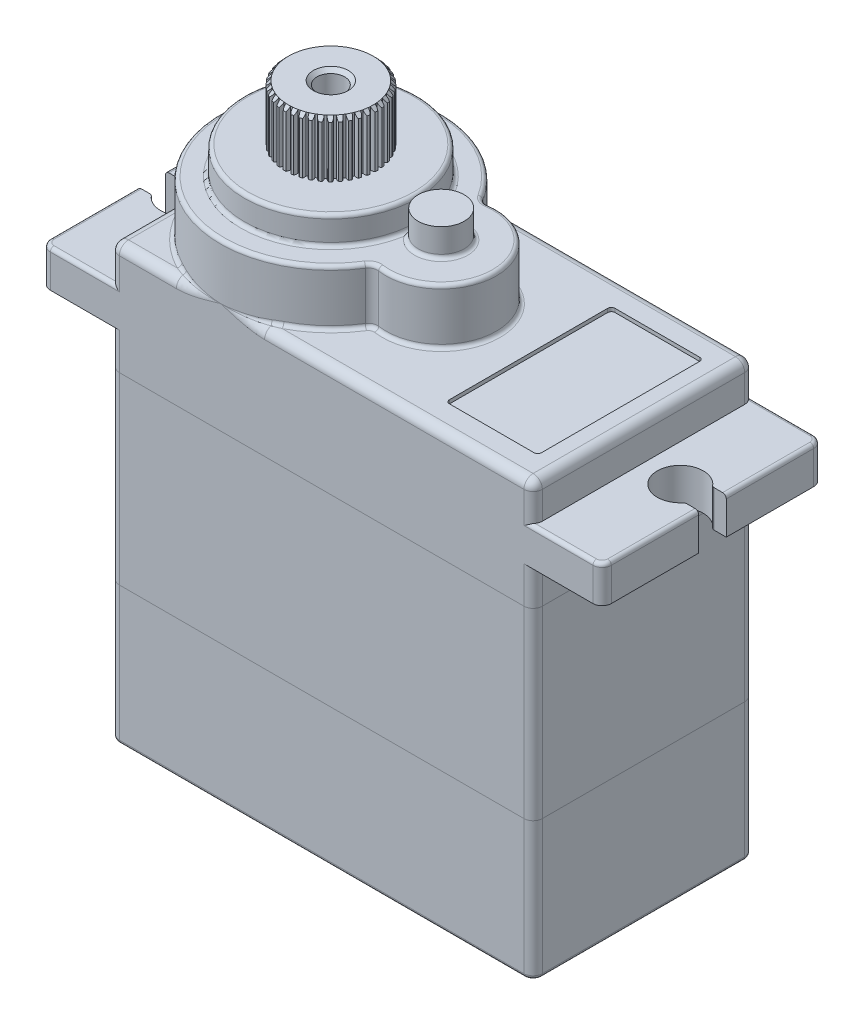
SolidWorks part; units mm, degrees
ref_plane "Front Plane" through (0, 0, 0) normal (0, 0, 1) x (1, 0, 0)
ref_plane "Top Plane" through (0, 0, 0) normal (0, 1, 0) x (1, 0, 0)
ref_plane "Right Plane" through (0, 0, 0) normal (1, 0, 0) x (0, 0, -1)
sketch "Sketch1" plane through (0, 0, 0) normal (0, 1, 0) x (1, 0, 0)
  line L1 (-11.5, 6) -> (11.5, 6)
  line L2 (-11.5, 6) -> (-11.5, -6)
  line L3 (-11.5, -6) -> (11.5, -6)
  line L4 (11.5, 6) -> (11.5, -6)
  line L5 (-11.5, 6) -> (11.5, -6) construction
  line L6 (-11.5, -6) -> (11.5, 6) construction
  point P0 (0, 0)
  dimension "D1" = 12
  dimension "D2" = 23
extrude "Boss-Extrude1" add sketch "Sketch1" along normal blind 23.5
sketch "Sketch2" plane through (0, 23.5, 0) normal (0, 1, 0) x (1, 0, 0)
  line L0 (-11.5, 0) -> (11.5, 0) construction
  line L1 (-11.5, 6) -> (-11.5, -6) construction
  line L2 (11.5, -6) -> (11.5, 6) construction
  line L3 (-11.5, -6) -> (11.5, -6) construction
  arc A0 (-0.4231, 3.1976) -> (-0.4231, -3.1976) centre (-5.5, 0) ccw
  arc A1 (0.0714, -2.9692) -> (0.0714, 2.9692) centre (0.5, 0) ccw
  arc A2 (0.0714, -2.9692) -> (-0.4231, -3.1976) centre (0, -3.4641) ccw
  arc A3 (0.0714, 2.9692) -> (-0.4231, 3.1976) centre (0, 3.4641) cw
  point P12 (3.5, 0)
  dimension "D2" = 6
  dimension "D3" = 0.5
  dimension "D1" = 15
extrude "Boss-Extrude2" add sketch "Sketch2" along normal blind 4.5
sketch "Sketch3" plane through (0, 28, 0) normal (0, 1, 0) x (1, 0, 0)
  circle A0 centre (-5.5, 0) radius 4.7
  circle A1 centre (0.5, 0) radius 1.25
  arc A4 (0.0714, -2.9692) -> (-0.4231, -3.1976) centre (0, -3.4641) ccw
  arc A5 (0.0714, -2.9692) -> (0.0714, 2.9692) centre (0.5, 0) ccw
  arc A6 (-0.4231, 3.1976) -> (0.0714, 2.9692) centre (0, 3.4641) ccw
  arc A7 (-0.4231, 3.1976) -> (-0.4231, -3.1976) centre (-5.5, 0) ccw
  arc A8 (0.0714, -2.9692) -> (-0.4231, -3.1976) centre (0, -3.4641) ccw
  arc A9 (0.0714, -2.9692) -> (0.0714, 2.9692) centre (0.5, 0) ccw
  arc A10 (-0.4231, 3.1976) -> (0.0714, 2.9692) centre (0, 3.4641) ccw
  arc A11 (-0.4231, 3.1976) -> (-0.4231, -3.1976) centre (-5.5, 0) ccw
  dimension "D2" = 9.4
  dimension "D3" = 2.5
  dimension "D1" = 0
extrude "Cut-Extrude1" cut sketch "Sketch3" against normal blind 1.5
sketch "Sketch4" plane through (0, 28, 0) normal (0, 1, 0) x (1, 0, 0)
  circle A0 centre (-5.5, 0) radius 2.5
  circle A1 centre (-5.5, 0) radius 0.75
  dimension "D1" = 5
  dimension "D2" = 1.5
extrude "Boss-Extrude3" add sketch "Sketch4" along normal blind 3 separate body
fillet "Fillet2" radius 0.5 11 edges at (-11.5, 23.5, -3) (-8.5, 23.5, -6) (-8.5, 23.5, 6) (-11.5, 23.5, 3) (3, 23.5, -6) (3, 23.5, 6) (11.5, 23.5, 0) (-11.5, 11.75, -6) (-11.5, 11.75, 6) (11.5, 11.75, 6) (11.5, 11.75, -6)
fillet "Fillet3" radius 0.2 28 edges at (-4.2753, 23.5, 5.8737) (-6.7247, 23.5, 5.8737) (-9.7426, 23.5, 4.2426) (-11.3737, 23.5, 1.2247) (-11.3737, 23.5, -1.2247) (-9.7426, 23.5, -4.2426) (-6.7247, 23.5, -5.8737) (-4.2753, 23.5, -5.8737) (-5.5, 28, 4.7) (-0.2097, 26.5, 3.0102) (-11.5, 26.5, 0) (-0.2097, 26.5, -3.0102) (3.5, 26.5, 0) (-5.5, 26.5, 4.7) (0.5, 26.5, 1.25) (-1.5893, 23.5, 4.5504) (-0.2097, 23.5, 3.0102) (3.5, 23.5, 0) (-0.2097, 23.5, -3.0102) (-1.5893, 23.5, -4.5504) (-11.3536, 0, 5.8536) (0, 0, 6) (11.3536, 0, 5.8536) (11.5, 0, 0) (11.3536, 0, -5.8536) (0, 0, -6) (-11.3536, 0, -5.8536) (-11.5, 0, 0)
sketch "Sketch5" plane through (0, 0, 6) normal (0, 0, 1) x (1, 0, 0)
  line L0 (-16.9716, 7.5) -> (15.5665, 7.5)
  line L1 (11, 0) -> (-11, 0) construction
  dimension "D1" = 7.5
split "Split1" trim tools "Sketch5" bodies to split 104 103 resulting bodies 105 106 107
ref_plane "Plane1" through (0, 21.5, 0) normal (0, 1, 0) x (1, 0, 0)
sketch "Sketch8" plane through (0, 21.5, 0) normal (0, 1, 0) x (1, 0, 0)
  line L0 (11, -5.5) -> (11, 5.5) construction
  line L1 (11, 6) -> (15.25, 6)
  line L2 (11, 6) -> (11, -6)
  line L3 (11, -6) -> (15.25, -6)
  line L4 (15.25, 6) -> (15.25, 0.75)
  line L5 (-11.5, 0) -> (11.5, 0) construction
  line L6 (11.5, 5.5) -> (11.5, -5.5) construction
  line L7 (15.25, 0.75) -> (14.5, 0.75)
  line L8 (15.25, -0.75) -> (14.5, -0.75)
  line L9 (15.25, -0.75) -> (15.25, -6)
  arc A0 (-0.4231, 3.1976) -> (-0.4231, -3.1976) centre (-5.5, 0) ccw construction
  arc A1 (14.5, 0.75) -> (14.5, -0.75) centre (13.5, 0) ccw
  point P15 (12.25, 0)
  dimension "D5" = 2.5
  dimension "D1" = 12
  dimension "D2" = 4.25
  dimension "D3" = 3
  dimension "D4" = 1.5
extrude "Boss-Extrude4" add sketch "Sketch8" against normal blind 2
ref_plane "Plane2" through (0, 0, 0) normal (1, 0, 0) x (0, 0, -1)
mirror "Mirror1" about plane through (0, 0, 0) normal (1, 0, 0) of "Boss-Extrude4"
fillet "Fillet4" radius 0.5 4 edges at (-15.25, 20.5, -6) (-15.25, 20.5, 6) (15.25, 20.5, 6) (15.25, 20.5, -6)
fillet "Fillet5" radius 0.2 16 edges at (-15.25, 21.5, -3.125) (-15.1036, 21.5, -5.8536) (-15.25, 21.5, 3.125) (-15.1036, 21.5, 5.8536) (15.25, 21.5, -3.125) (15.1036, 21.5, -5.8536) (12.875, 21.5, 6) (15.1036, 21.5, 5.8536) (-14.5, 20.5, 0.75) (-14.5, 20.5, -0.75) (-12.875, 21.5, -6) (-12.875, 21.5, 6) (14.5, 20.5, 0.75) (14.5, 20.5, -0.75) (12.875, 21.5, -6) (15.25, 21.5, 3.125)
sketch "Sketch9" plane through (0, 23.5, 0) normal (0, 1, 0) x (1, 0, 0)
  line L0 (-15.25, 0) -> (11.3606, 0) construction
  line L2 (5.45, 4.5) -> (10.05, 4.5)
  line L3 (5.25, 4.3) -> (5.25, -4.3)
  line L4 (5.45, -4.5) -> (10.05, -4.5)
  line L5 (10.25, 4.3) -> (10.25, -4.3)
  line L6 (5.25, 4.5) -> (10.25, -4.5) construction
  line L7 (5.25, -4.5) -> (10.25, 4.5) construction
  line L8 (11.5, -5.5) -> (11.5, 5.5) construction
  arc A0 (5.25, -4.3) -> (5.45, -4.5) centre (5.45, -4.3) ccw
  arc A1 (10.05, -4.5) -> (10.25, -4.3) centre (10.05, -4.3) ccw
  arc A2 (10.05, 4.5) -> (10.25, 4.3) centre (10.05, 4.3) cw
  arc A3 (5.45, 4.5) -> (5.25, 4.3) centre (5.45, 4.3) ccw
  point P3 (7.75, 0)
  dimension "D4" = 0.2
  dimension "D1" = 5
  dimension "D2" = 9
  dimension "D3" = 1.25
extrude "Cut-Extrude2" cut sketch "Sketch9" against normal blind 0.2
sketch "Sketch10" plane through (0, 0, 6) normal (0, 0, 1) x (1, 0, 0)
  line L0 (-13.26, 17.5) -> (17.901, 17.5)
  line L1 (-2.6382, 23.5) -> (11, 23.5) construction
  dimension "D1" = 6
split "Split2" trim tools "Sketch10" bodies to split 110 105 106 resulting bodies 111 112 113 114
chamfer "Chamfer1" distance 0.2 angle 45 2 edges at (-5.5, 31, 0.75) (-5.5, 31, 2.5)
sketch "Sketch12" plane through (0, 31, 0) normal (0, 1, 0) x (1, 0, 0)
  line L0 (-5.5, 0) -> (-3.9935, 1.738) construction
  circle A0 centre (-5.5, 0) radius 2.3 construction
  arc A1 (-4.0373, 1.775) -> (-3.9591, 1.9686) centre (-4.2437, 1.971) ccw
  circle A2 centre (-5.5, 0) radius 2.5 construction
  arc A3 (-3.9507, 1.6999) -> (-3.7701, 1.8049) centre (-3.7273, 1.5235) cw
  arc A4 (-3.9507, 1.6999) -> (-4.0373, 1.775) centre (-5.5, 0) ccw
  arc A5 (-3.7701, 1.8049) -> (-3.9591, 1.9686) centre (-5.5, 0) ccw
  point P0 (-4.0373, 1.775)
  point P6 (-3.9507, 1.6999)
  dimension "D1" = 0.25
extrude "Cut-Extrude3" cut sketch "Sketch12" against normal up to surface (3 mm away)
pattern_circular "CirPattern1" count 40 over 360 about axis through (-5.5, 0, 0) along (0, 1, 0) of "Cut-Extrude3"
